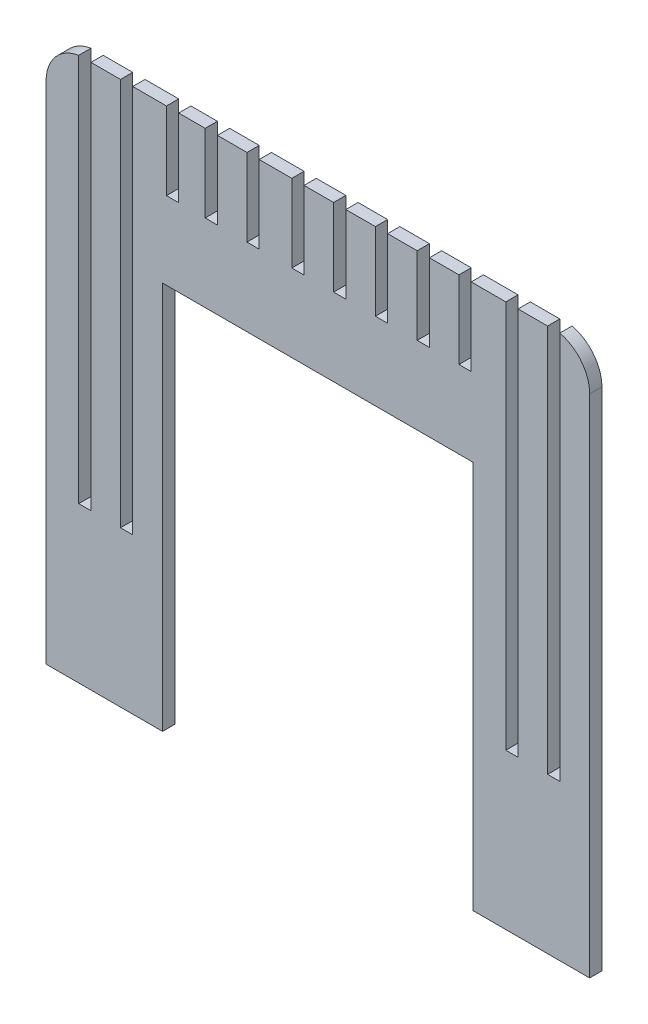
SolidWorks part; units mm, degrees
ref_plane "Front Plane" through (0, 0, 0) normal (0, 0, 1) x (1, 0, 0)
ref_plane "Top Plane" through (0, 0, 0) normal (0, 1, 0) x (1, 0, 0)
ref_plane "Right Plane" through (0, 0, 0) normal (1, 0, 0) x (0, 0, -1)
sketch "Sketch1" plane through (0, 0, 0) normal (0, 0, 1) x (1, 0, 0)
  line L0 (-50.8, 163.4747) -> (50.8, 163.4747)
  line L1 (50.8, 36.4747) -> (88.9, 36.4747)
  line L2 (-50.8, 36.4747) -> (-88.9, 36.4747)
  line L3 (-74.232, 214.2747) -> (-64.564, 214.2747)
  line L4 (-60.564, 214.2747) -> (-49.53, 214.2747)
  line L5 (-78.232, 214.2747) -> (-78.232, 87.2747)
  line L6 (-78.232, 87.2747) -> (-74.232, 87.2747)
  line L7 (-50.8, 36.4747) -> (-50.8, 163.4747)
  line L8 (-74.232, 214.2747) -> (-74.232, 87.2747)
  line L9 (50.8, 163.4747) -> (50.8, 36.4747)
  line L10 (-45.53, 214.2747) -> (-36.862, 214.2747)
  line L11 (-64.564, 214.2747) -> (-64.564, 87.2747)
  line L12 (-88.9, 36.4747) -> (-88.9, 214.2747)
  line L13 (-88.9, 214.2747) -> (-78.232, 214.2747)
  line L14 (88.9, 36.4747) -> (88.9, 214.2747)
  line L15 (-64.564, 87.2747) -> (-60.564, 87.2747)
  line L16 (-60.564, 214.2747) -> (-60.564, 87.2747)
  line L17 (-32.862, 214.2747) -> (-23.194, 214.2747)
  line L18 (-49.53, 214.2747) -> (-49.53, 188.8747)
  line L19 (-49.53, 188.8747) -> (-45.53, 188.8747)
  line L20 (-45.53, 214.2747) -> (-45.53, 188.8747)
  line L21 (-19.194, 214.2747) -> (-8.526, 214.2747)
  line L22 (-4.526, 214.2747) -> (5.142, 214.2747)
  line L23 (-36.862, 214.2747) -> (-36.862, 188.8747)
  line L24 (-36.862, 188.8747) -> (-32.862, 188.8747)
  line L25 (-32.862, 214.2747) -> (-32.862, 188.8747)
  line L26 (9.142, 214.2747) -> (18.81, 214.2747)
  line L27 (-23.194, 214.2747) -> (-23.194, 188.8747)
  line L28 (-23.194, 188.8747) -> (-19.194, 188.8747)
  line L29 (-19.194, 214.2747) -> (-19.194, 188.8747)
  line L30 (22.81, 214.2747) -> (32.478, 214.2747)
  line L31 (-8.526, 214.2747) -> (-8.526, 188.8747)
  line L32 (-8.526, 188.8747) -> (-4.526, 188.8747)
  line L33 (-4.526, 214.2747) -> (-4.526, 188.8747)
  line L34 (36.478, 214.2747) -> (46.146, 214.2747)
  line L35 (5.142, 214.2747) -> (5.142, 188.8747)
  line L36 (5.142, 188.8747) -> (9.142, 188.8747)
  line L37 (9.142, 214.2747) -> (9.142, 188.8747)
  line L38 (50.146, 214.2747) -> (61.468, 214.2747)
  line L39 (18.81, 214.2747) -> (18.81, 188.8747)
  line L40 (18.81, 188.8747) -> (22.81, 188.8747)
  line L41 (22.81, 214.2747) -> (22.81, 188.8747)
  line L42 (65.468, 214.2747) -> (75.136, 214.2747)
  line L43 (32.478, 214.2747) -> (32.478, 188.8747)
  line L44 (32.478, 188.8747) -> (36.478, 188.8747)
  line L45 (36.478, 214.2747) -> (36.478, 188.8747)
  line L46 (79.136, 214.2747) -> (88.9, 214.2747)
  line L47 (46.146, 214.2747) -> (46.146, 188.8747)
  line L48 (46.146, 188.8747) -> (50.146, 188.8747)
  line L49 (50.146, 214.2747) -> (50.146, 188.8747)
  line L51 (61.468, 214.2747) -> (61.468, 87.2747)
  line L52 (61.468, 87.2747) -> (65.468, 87.2747)
  line L54 (65.468, 214.2747) -> (65.468, 87.2747)
  line L56 (75.136, 214.2747) -> (75.136, 87.2747)
  line L58 (75.136, 87.2747) -> (79.136, 87.2747)
  line L59 (79.136, 214.2747) -> (79.136, 87.2747)
  point P0 (0, 0)
extrude "Boss-Extrude1" add sketch "Sketch1" along normal blind 4
fillet "Fillet2" radius 12.7 1 edges at (-88.9, 214.2747, 2)
fillet "Fillet3" radius 12.7 1 edges at (88.9, 214.2747, 2)
equation "\"major-height\"= 7in"
equation "\"major-teeth-height\"= 5in"
equation "\"minor-height\"= 2in"
equation "\"minor-teeth height\"= 1in"
equation "\"distance-between-teeth\"= 0.42"
equation "\"sheet-thickness\" = 4mm"
equation "\"width\"= 7in"
equation "\"D1@Boss-Extrude1\"=\"sheet-thickness\""
equation "\"edges\"= 0.5in"
equation "\"D1@Fillet1\"=\"edges\""
equation "\"D1@Fillet2\"=\"edges\""
equation "\"D1@Sketch1\"=\"sheet-thickness\""
equation "\"D3@Sketch1\"=\"sheet-thickness\""
equation "\"D4@Sketch1\"=\"major-teeth-height\""
equation "\"D5@Sketch1\"=\"sheet-thickness\""
equation "\"D6@Sketch1\"=\"minor-teeth height\""
equation "\"D7@Sketch1\"=\"sheet-thickness\""
equation "\"D8@Sketch1\"=\"major-teeth-height\""
equation "\"D9@Sketch1\"=\"sheet-thickness\""
equation "\"D10@Sketch1\"=\"major-teeth-height\""
equation "\"D11@Sketch1\"=\"sheet-thickness\""
equation "\"D13@Sketch1\"=\"sheet-thickness\""
equation "\"D14@Sketch1\"=\"minor-teeth height\""
equation "\"D15@Sketch1\"=\"sheet-thickness\""
equation "\"D16@Sketch1\"=\"minor-teeth height\""
equation "\"D17@Sketch1\"=\"sheet-thickness\""
equation "\"D18@Sketch1\"=\"minor-teeth height\""
equation "\"D19@Sketch1\"=\"sheet-thickness\""
equation "\"D20@Sketch1\"=\"minor-teeth height\""
equation "\"D21@Sketch1\"=\"sheet-thickness\""
equation "\"D22@Sketch1\"=\"minor-teeth height\""
equation "\"D23@Sketch1\"=\"sheet-thickness\""
equation "\"D24@Sketch1\"=\"minor-teeth height\""
equation "\"D1@Fillet3\"=\"edges\""
